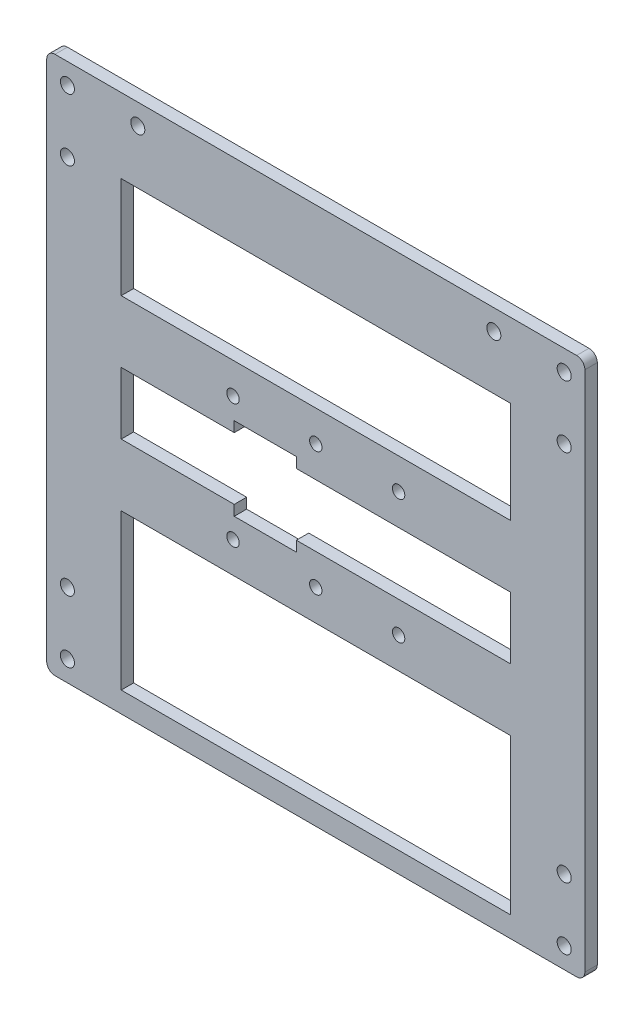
SolidWorks part; units mm, degrees
ref_plane "前视基准面" through (0, 0, 0) normal (0, 0, 1) x (1, 0, 0)
ref_plane "上视基准面" through (0, 0, 0) normal (0, 1, 0) x (1, 0, 0)
ref_plane "右视基准面" through (0, 0, 0) normal (1, 0, 0) x (0, 0, -1)
sketch "草图1" plane through (0, 0, 0) normal (0, 0, 1) x (1, 0, 0)
  line L1 (-65, 65) -> (65, 65)
  line L2 (-65, 65) -> (-65, -65)
  line L3 (-65, -65) -> (65, -65)
  line L4 (65, 65) -> (65, -65)
  line L5 (-65, 65) -> (65, -65) construction
  line L6 (-65, -65) -> (65, 65) construction
  point P0 (0, 0)
  dimension "D1" = 130
  dimension "D2" = 130
extrude "凸台-拉伸1" add sketch "草图1" along normal blind 3
hole_wizard "Ø3.0 (3) 直径孔1" positions "草图4" profile "草图3" hole size "Ø3.0" standard "GB"
sketch "草图4" plane through (0, 0, 3) normal (0, 0, 1) x (1, 0, 0)
  point P0 (-20, 15)
  point P3 (-20, -15)
  point P6 (20, -15)
  point P9 (20, 15)
  dimension "D1" = 40
  dimension "D2" = 40
  dimension "D3" = 30
  dimension "D4" = 30
  dimension "D5" = 15
  dimension "D6" = 20
  dimension "D7" = 20
  dimension "D8" = 15
sketch "草图3" plane through (-20, 15, 3) normal (1, 0, 0) x (0, -1, 0)
  line L0 (0, 0) -> (0, 3)
  line L1 (0, 3) -> (1.5, 3)
  line L2 (1.5, 3) -> (1.5, 0)
  line L5 (1.5, 0) -> (0, 0)
  line L11 (0, -6.35) -> (0, 107.95) construction
  dimension "通孔孔直径" = 3
  dimension "通孔孔深度" = 3
sketch "草图5" plane through (0, 0, 3) normal (0, 0, 1) x (1, 0, 0)
  line L1 (-47, 32.5) -> (47, 32.5)
  line L2 (-47, 32.5) -> (-47, 22.5)
  line L3 (-47, 22.5) -> (47, 22.5)
  line L4 (47, 32.5) -> (47, 22.5)
  line L5 (-47, 7.5) -> (47, 7.5)
  line L6 (-47, 7.5) -> (-47, -7.5)
  line L7 (-47, -7.5) -> (47, -7.5)
  line L8 (47, 7.5) -> (47, -7.5)
  line L9 (-47, 7.5) -> (47, -7.5) construction
  line L10 (-47, -7.5) -> (47, 7.5) construction
  line L11 (-47, -22.5) -> (47, -22.5)
  line L12 (-47, -22.5) -> (-47, -32.5)
  line L13 (-47, -32.5) -> (47, -32.5)
  line L14 (47, -22.5) -> (47, -32.5)
  point P4 (0, 0)
  dimension "D1" = 15
  dimension "D2" = 94
  dimension "D3" = 94
  dimension "D4" = 94
  dimension "D5" = 47
  dimension "D6" = 47
  dimension "D7" = 10
  dimension "D8" = 10
  dimension "D9" = 15
  dimension "D10" = 15
extrude "切除-拉伸1" cut sketch "草图5" against normal blind 3
sketch "草图6" plane through (0, 0, 0) normal (0, 0, -1) x (-1, 0, 0)
  line L0 (47, -7.5) -> (-47, -7.5) construction
  line L1 (19.2, -7.5) -> (7.2, -7.5)
  line L2 (19.2, -7.5) -> (19.2, -9.5)
  line L3 (19.2, -9.5) -> (7.2, -9.5)
  line L4 (7.2, -7.5) -> (7.2, -9.5)
  line L5 (-47, 7.5) -> (47, 7.5) construction
  line L6 (19.2, 7.5) -> (7.2, 7.5)
  line L7 (19.2, 7.5) -> (19.2, 9.5)
  line L8 (19.2, 9.5) -> (7.2, 9.5)
  line L9 (7.2, 7.5) -> (7.2, 9.5)
  line L10 (19.2, -7.5) -> (19.2, 7.5) construction
  dimension "D1" = 2
  dimension "D2" = 12
  dimension "D3" = 2
  dimension "D4" = 12
  dimension "D5" = 0
  dimension "D6" = 0
extrude "切除-拉伸2" cut sketch "草图6" against normal blind 3
fillet "圆角1" radius 3 4 edges at (-7.2, -9.5, 1.5) (-19.2, -9.5, 1.5) (-7.2, 9.5, 1.5) (-19.2, 9.5, 1.5)
sketch "草图7" plane through (0, 0, 0) normal (0, 0, -1) x (-1, 0, 0)
  line L1 (-47, 32.5) -> (47, 32.5)
  line L2 (-47, 32.5) -> (-47, 47)
  line L3 (-47, 47) -> (47, 47)
  line L4 (47, 32.5) -> (47, 47)
extrude "切除-拉伸3" cut sketch "草图7" against normal blind 3
sketch "草图8" plane through (0, 0, 3) normal (0, 0, 1) x (1, 0, 0)
  line L1 (-47, -32.5) -> (47, -32.5)
  line L2 (-47, -32.5) -> (-47, -60)
  line L3 (-47, -60) -> (47, -60)
  line L4 (47, -32.5) -> (47, -60)
  line L6 (-65, -65) -> (65, -65) construction
  line L7 (47, -47) -> (47, 47) construction
  line L8 (-47, 47) -> (-47, -47) construction
  line L9 (-47, -32.5) -> (47, -32.5) construction
  dimension "D1" = 5
  dimension "D2" = 0
extrude "切除-拉伸4" cut sketch "草图8" against normal blind 3
hole_wizard "Ø3.0 (3) 直径孔2" positions "草图9" profile "草图10" hole size "Ø3.0" standard "GB"
sketch "草图9" plane through (0, 0, 3) normal (0, 0, 1) x (1, 0, 0)
  line L0 (47, 7.5) -> (-7.2, 7.5) construction
  line L1 (-7.2, -7.5) -> (47, -7.5) construction
  point P0 (0, -15)
  point P2 (0, 15)
  dimension "D1" = 7.5
  dimension "D2" = 7.5
sketch "草图10" plane through (0, -15, 3) normal (1, 0, 0) x (0, -1, 0)
  line L0 (0, 0) -> (0, 3)
  line L1 (0, 3) -> (1.5, 3)
  line L2 (1.5, 3) -> (1.5, 0)
  line L5 (1.5, 0) -> (0, 0)
  line L11 (0, -6.35) -> (0, 107.95) construction
  dimension "通孔孔直径" = 3
  dimension "通孔孔深度" = 3
sketch "草图11" plane through (0, 0, 0) normal (0, 0, -1) x (-1, 0, 0)
  line L0 (19.2, 7.5) -> (47, 7.5) construction
  line L1 (4.7, 10) -> (19.7, 10)
  line L2 (4.7, 10) -> (4.7, 7.5)
  line L3 (4.7, 7.5) -> (19.7, 7.5)
  line L4 (19.7, 10) -> (19.7, 7.5)
  line L5 (19.7, -10) -> (19.7, 10) construction
  line L6 (47, -7.5) -> (19.2, -7.5) construction
  line L7 (4.7, -10) -> (19.7, -10)
  line L8 (4.7, -10) -> (4.7, -7.5)
  line L9 (4.7, -7.5) -> (19.7, -7.5)
  line L10 (19.7, -10) -> (19.7, -7.5)
extrude "切除-拉伸5" cut sketch "草图11" against normal through all
fillet "圆角2" radius 2 4 edges at (65, -65, 1.5) (-65, -65, 1.5) (-65, 65, 1.5) (65, 65, 1.5)
hole_wizard "Ø3.4 (3.4) 直径孔1" positions "草图12" profile "草图13" hole size "Ø3.4" standard "GB"
sketch "草图12" plane through (0, 0, 0) normal (0, 0, -1) x (-1, 0, 0)
  line L0 (-63, 65) -> (63, 65) construction
  line L1 (-65, -63) -> (-65, 63) construction
  line L2 (65, 63) -> (65, -63) construction
  line L3 (63, -65) -> (-63, -65) construction
  point P0 (-60, 60)
  point P2 (60, 60)
  point P4 (60, -60)
  point P6 (-60, -60)
  dimension "D1" = 5
  dimension "D2" = 5
  dimension "D3" = 5
  dimension "D4" = 5
  dimension "D5" = 5
  dimension "D6" = 5
  dimension "D7" = 5
  dimension "D8" = 5
sketch "草图13" plane through (60, 60, 0) normal (1, 0, 0) x (0, 1, 0)
  line L0 (0, 0) -> (0, 3)
  line L1 (0, 3) -> (1.7, 3)
  line L2 (1.7, 3) -> (1.7, 0)
  line L5 (1.7, 0) -> (0, 0)
  line L11 (0, -6.35) -> (0, 107.95) construction
  dimension "通孔孔直径" = 3.4
  dimension "通孔孔深度" = 3
hole_wizard "Ø3.4 (3.4) 直径孔2" positions "草图14" profile "草图15" hole size "Ø3.4" standard "GB"
sketch "草图14" plane through (0, 0, 3) normal (0, 0, 1) x (1, 0, 0)
  point P0 (60, 45)
  point P3 (60, -45)
  point P6 (-60, -45)
  point P11 (-43, 60)
  point P14 (43, 60)
  point P19 (-60, 45)
sketch "草图15" plane through (60, 45, 3) normal (1, 0, 0) x (0, -1, 0)
  line L0 (0, 0) -> (0, 3)
  line L1 (0, 3) -> (1.7, 3)
  line L2 (1.7, 3) -> (1.7, 0)
  line L5 (1.7, 0) -> (0, 0)
  line L11 (0, -6.35) -> (0, 107.95) construction
  dimension "通孔孔直径" = 3.4
  dimension "通孔孔深度" = 3
